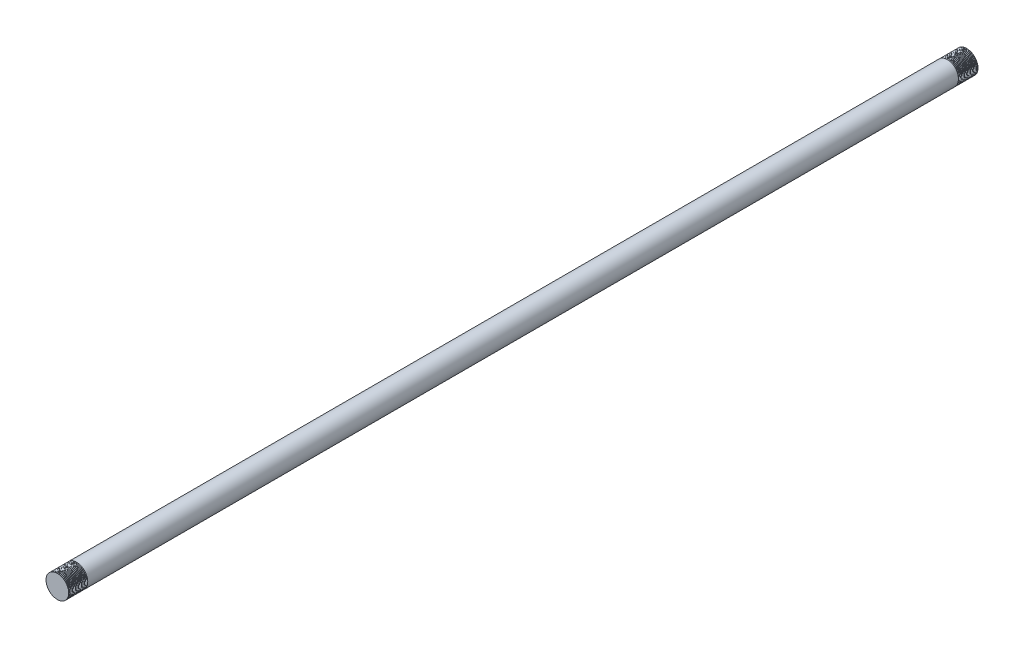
SolidWorks part; units mm, degrees
other "<TailWingThroughLink>-<Thread2>"
ref_plane "Front Plane" through (0, 0, 0) normal (0, 0, 1) x (1, 0, 0)
ref_plane "Top Plane" through (0, 0, 0) normal (0, 1, 0) x (1, 0, 0)
ref_plane "Right Plane" through (0, 0, 0) normal (1, 0, 0) x (0, 0, -1)
mirrored part "TailWingThroughLink_Mirrored"
